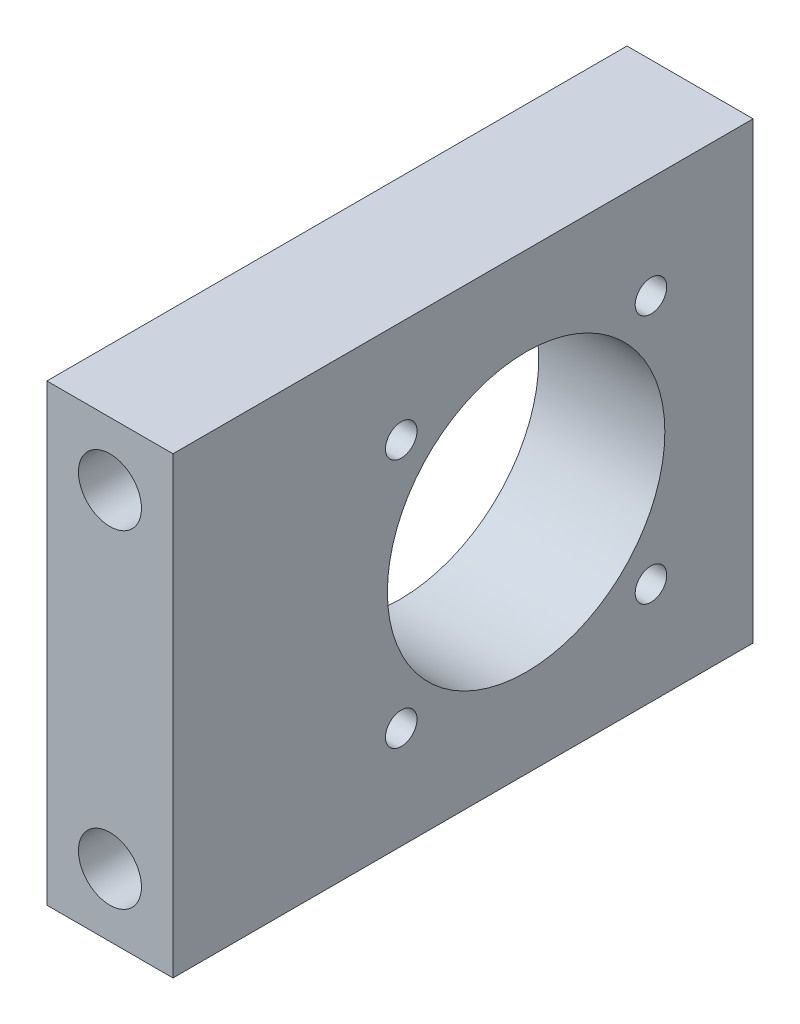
SolidWorks part; units mm, degrees
ref_plane "Front Plane" through (0, 0, 0) normal (0, 0, 1) x (1, 0, 0)
ref_plane "Top Plane" through (0, 0, 0) normal (0, 1, 0) x (1, 0, 0)
ref_plane "Right Plane" through (0, 0, 0) normal (1, 0, 0) x (0, 0, -1)
sketch "Sketch1" plane through (0, 0, 0) normal (1, 0, 0) x (0, 0, -1)
  line L0 (-28, -18) -> (18, -18)
  line L1 (18, -18) -> (18, 18)
  line L2 (18, 18) -> (-28, 18)
  line L3 (-28, 18) -> (-28, -18)
  circle A0 centre (0, 0) radius 11
  dimension "D1" = 22
  dimension "D2" = 28
  dimension "D4" = 18
  dimension "D3" = 46
  dimension "D5" = 36
extrude "Boss-Extrude1" add sketch "Sketch1" along normal blind 10
hole_wizard "M6x1.0 Tapped Hole1" positions "Sketch3" profile "Sketch2" tap size "M6x1.0" standard "ANSI Metric"
sketch "Sketch3" plane through (0, 0, 28) normal (0, 0, 1) x (1, 0, 0)
  line L0 (5, 13) -> (5, -13) construction
  line L2 (10, 18) -> (10, -18) construction
  line L3 (10, -18) -> (0, -18) construction
  line L4 (10, 18) -> (0, 18) construction
  point P0 (5, 13)
  point P2 (5, -13)
  point P11 (5, -18)
  dimension "D1" = 5
  dimension "D2" = 5
  dimension "D3" = 5
sketch "Sketch2" plane through (5, 13, 28) normal (1, 0, 0) x (0, -1, 0)
  line L0 (0, 0) -> (0, 16.5022)
  line L1 (0, 16.5022) -> (2.5, 15)
  line L2 (2.5, 15) -> (2.5, 0)
  line L5 (2.5, 0) -> (0, 0)
  line L10 (0, 16.5022) -> (-2.5, 15) construction
  line L11 (0, -6.35) -> (0, 107.95) construction
  dimension "Tap Drill Dia." = 5
  dimension "Tap Drill Depth" = 15
  dimension "Drill Angle" = 118
hole_wizard "M3x0.5 Tapped Hole1" positions "Sketch5" profile "Sketch4" tap size "M3x0.5" standard "ANSI Metric"
sketch "Sketch5" plane through (10, 0, 0) normal (1, 0, 0) x (0, 0, -1)
  point P0 (9.8995, -9.8995)
  point P3 (-9.8995, -9.8995)
  point P6 (-9.8995, 9.8995)
  point P9 (9.8995, 9.8995)
sketch "Sketch4" plane through (10, -9.8995, -9.8995) normal (0, 1, 0) x (0, 0, -1)
  line L0 (0, 0) -> (0, 10)
  line L1 (0, 10) -> (1.25, 10)
  line L2 (1.25, 10) -> (1.25, 0)
  line L5 (1.25, 0) -> (0, 0)
  line L11 (0, -6.35) -> (0, 107.95) construction
  dimension "Thru Tap Drill Dia." = 2.5
  dimension "Thru Tap Drill Depth" = 10
